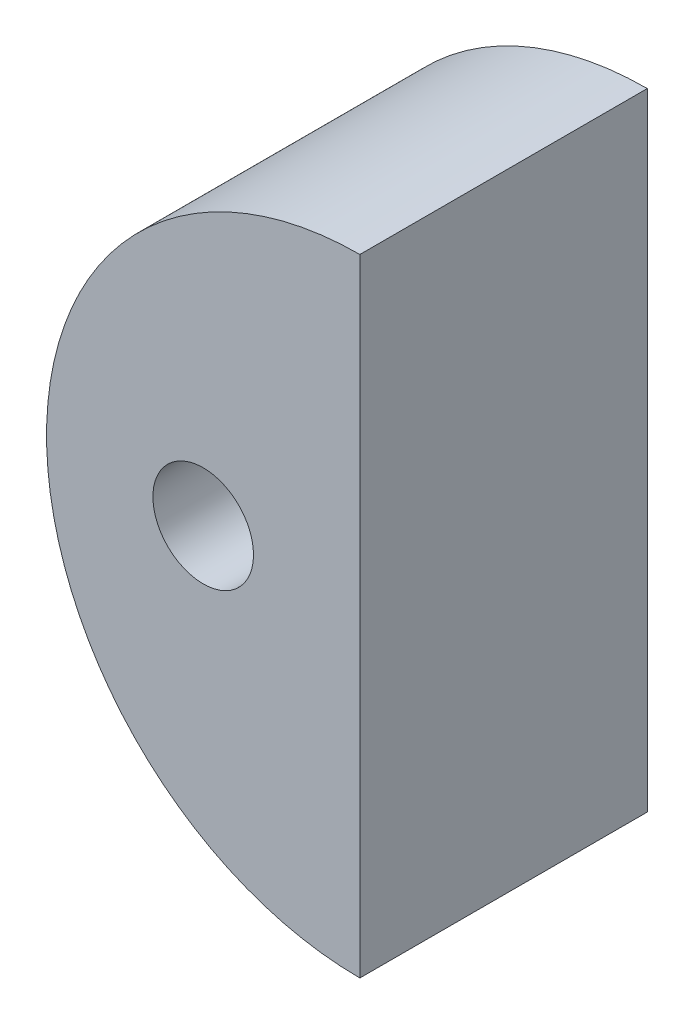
SolidWorks part; units mm, degrees
ref_plane "Plan de face" through (0, 0, 0) normal (0, 0, 1) x (1, 0, 0)
ref_plane "Plan de dessus" through (0, 0, 0) normal (0, 1, 0) x (1, 0, 0)
ref_plane "Plan de droite" through (0, 0, 0) normal (1, 0, 0) x (0, 0, -1)
sketch "Esquisse1" plane through (0, 0, 0) normal (0, 0, 1) x (1, 0, 0)
  line L2 (-30, 6.3) -> (-30, -15.5)
  line L3 (-30, -4.6) -> (-40.9, -4.6) construction
  arc A0 (-30, 6.3) -> (-30, -15.5) centre (-30, -4.6) ccw
  arc A2 (-30, -15.5) -> (-30, 6.3) centre (-30, -4.6) ccw construction
  circle A4 centre (-35.45, -4.6) radius 1.75
  dimension "D1" = 3.5
extrude "Boss.-Extru.1" add sketch "Esquisse1" along normal blind 10
